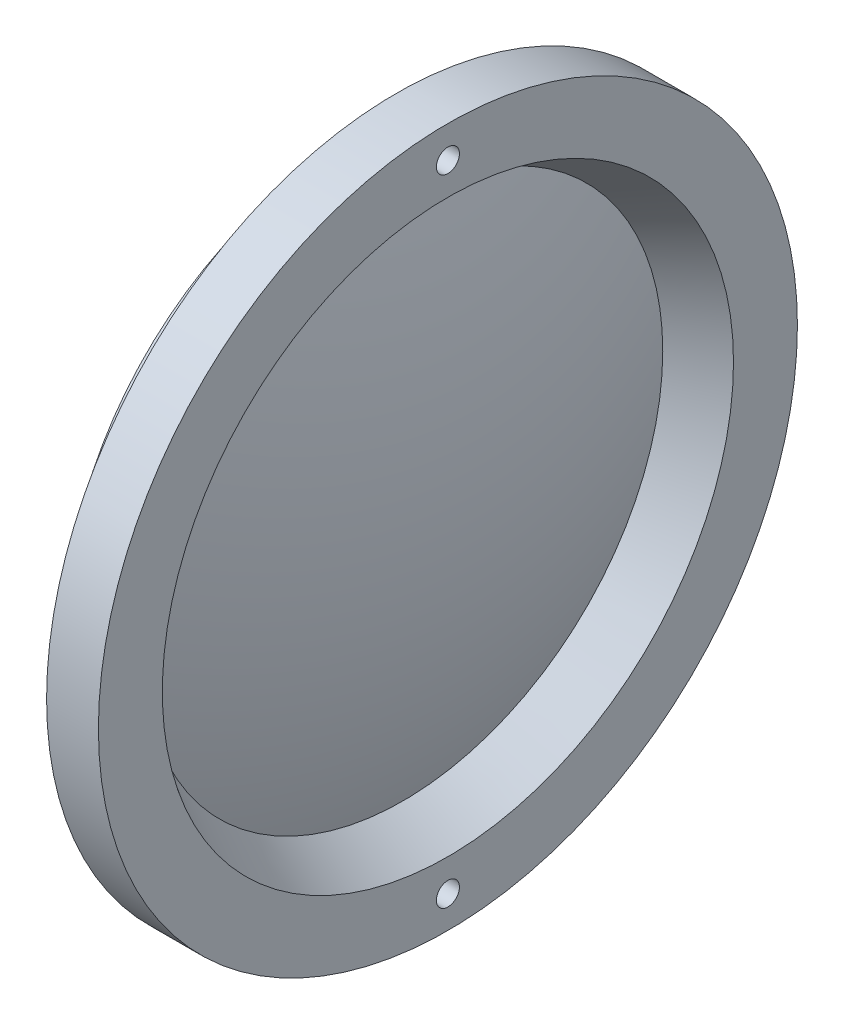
SolidWorks part; units mm, degrees
ref_plane "Front Plane" through (0, 0, 0) normal (0, 0, 1) x (1, 0, 0)
ref_plane "Top Plane" through (0, 0, 0) normal (0, 1, 0) x (1, 0, 0)
ref_plane "Right Plane" through (0, 0, 0) normal (1, 0, 0) x (0, 0, -1)
sketch "Sketch1" plane through (0, 0, 0) normal (0, 0, 1) x (1, 0, 0)
  line L1 (0, 12) -> (2.4, 12)
  line L3 (2.4, -12) -> (0, -12)
  line L5 (-7.2153, 0) -> (9.1683, 0) construction
  arc A0 (2.4, 12) -> (2.4, -12) centre (-30.8357, 0) cw
  arc A1 (0, 12) -> (0, -12) centre (-71.5, 0) cw
revolve "Revolve1" add sketch "Sketch1" angle 360 about L5
sketch "Sketch2" plane through (0, 0, 0) normal (0, 0, 1) x (1, 0, 0)
  line L0 (2.35, 12) -> (2.4, 12)
  line L1 (2.4, 12) -> (0, 12) construction
  line L3 (4.6, 15.175) -> (4.6, 12.3992)
  line L4 (2.35, 12) -> (2.35, 15.175)
  line L5 (2.35, 15.175) -> (4.6, 15.175)
  line L6 (0, 0) -> (-1.5951, 0) construction
  line L8 (0, 12) -> (0, -12) construction
  line L10 (2.6529, 11.275) -> (4.6, 12.3992)
  arc A0 (2.4, -12) -> (2.4, 12) centre (-30.8357, 0) ccw construction
  arc A1 (2.4, 12) -> (2.6529, 11.275) centre (-30.8357, 0) cw
revolve "Revolve2" add sketch "Sketch2" angle 360 about L6
sketch "Sketch3" plane through (4.6, 0, 0) normal (1, 0, 0) x (0, 0, -1)
  circle A3 centre (0, -13.7871) radius 0.5
  circle A4 centre (0, 13.7871) radius 0.5
extrude "Cut-Extrude1" cut sketch "Sketch3" against normal blind 1
